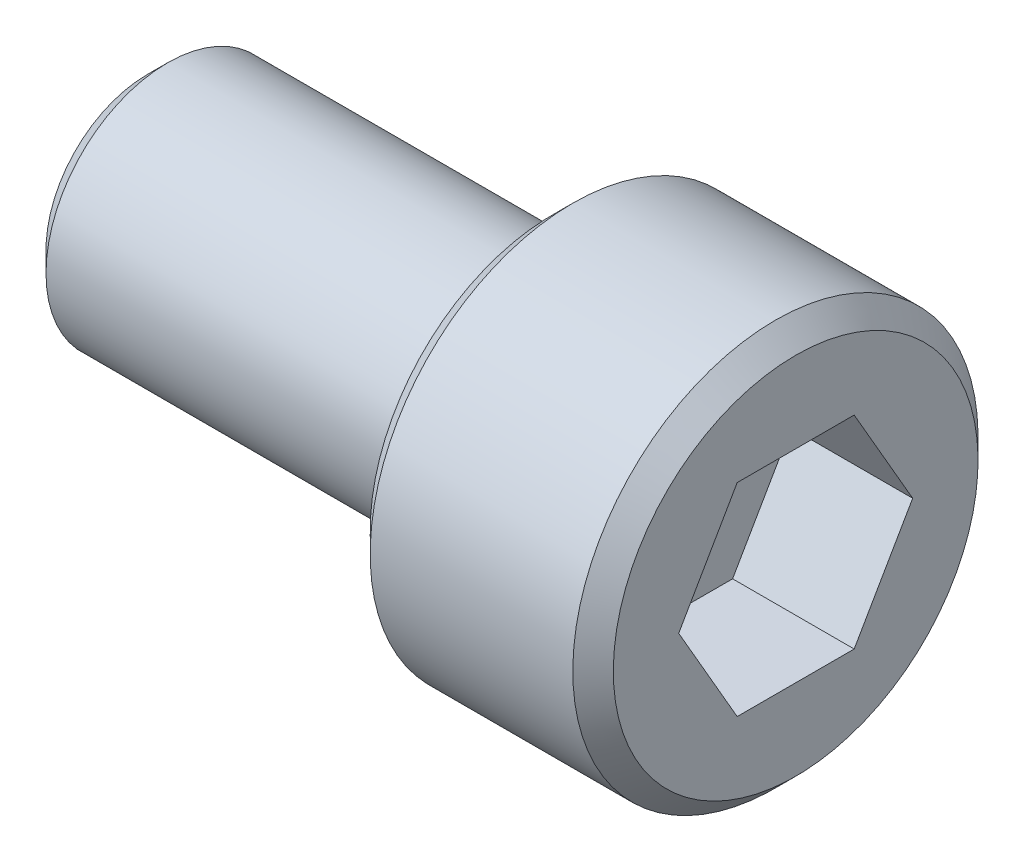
SolidWorks part; units mm, degrees
ref_plane "Plan de face" through (0, 0, 0) normal (0, 0, 1) x (1, 0, 0)
ref_plane "Plan de dessus" through (0, 0, 0) normal (0, 1, 0) x (1, 0, 0)
ref_plane "Plan de droite" through (0, 0, 0) normal (1, 0, 0) x (0, 0, -1)
sketch "Esquisse1" plane through (0, 0, 0) normal (0, 0, 1) x (1, 0, 0)
  line L0 (0, 0) -> (-16, 0) construction
  line L1 (-16, 0) -> (-16, 3)
  line L2 (-16, 3) -> (-6, 3)
  line L3 (-6, 3) -> (-6, 5)
  line L4 (-6, 5) -> (0, 5)
  line L5 (0, 5) -> (0, 0)
  line L6 (0, 0) -> (-16, 0)
  dimension "D1" = 6
  dimension "D2" = 10
  dimension "D3" = 6
  dimension "D4" = 10
revolve "Révolution1" add sketch "Esquisse1" angle 360 about L0
sketch "Esquisse2" plane through (0, 0, 0) normal (1, 0, 0) x (0, 0, -1)
  line L1 (2.8868, 0) -> (1.4434, 2.5)
  line L2 (1.4434, 2.5) -> (-1.4434, 2.5)
  line L3 (-1.4434, 2.5) -> (-2.8868, 0)
  line L4 (-2.8868, 0) -> (-1.4434, -2.5)
  line L5 (-1.4434, -2.5) -> (1.4434, -2.5)
  line L6 (1.4434, -2.5) -> (2.8868, 0)
  circle A0 centre (0, 0) radius 2.5 construction
  dimension "D1" = 5
extrude "Enlèv. mat.-Extru.1" cut sketch "Esquisse2" against normal blind 3
chamfer "Chanfrein2" distance 0.5 angle 45 3 edges at (0, 5, 0) (-6, 5, 0) (-16, 3, 0)
